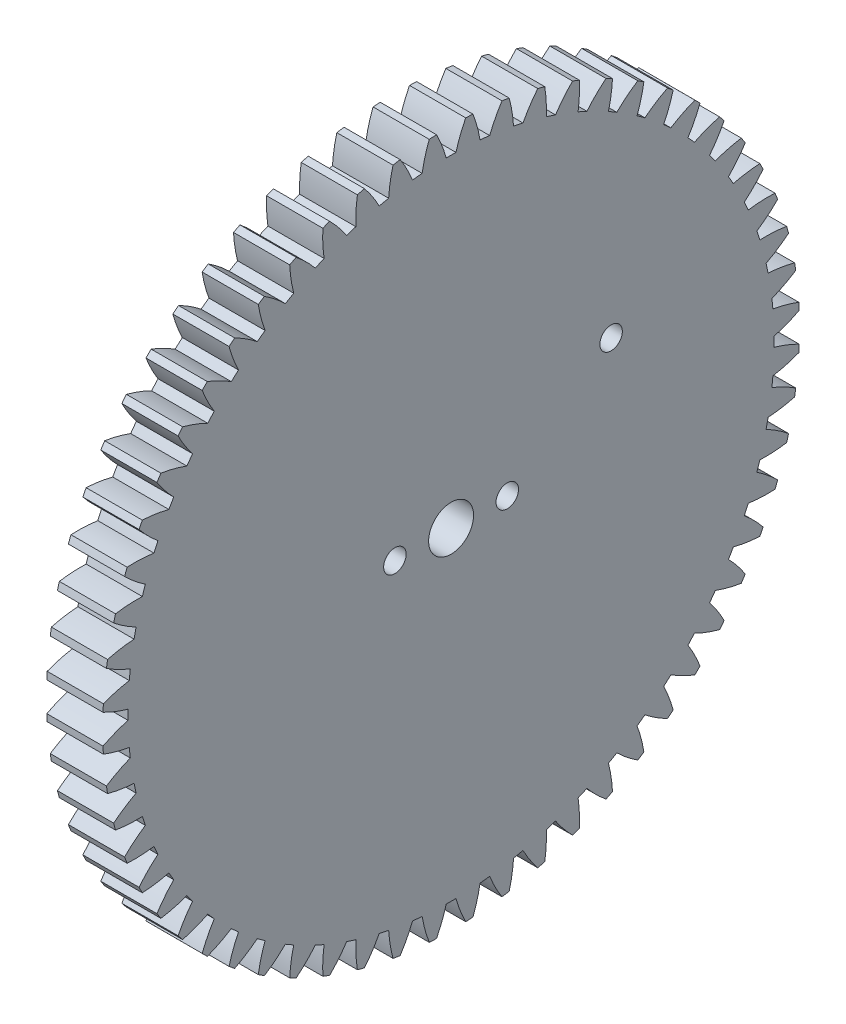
SolidWorks part; units mm, degrees
ref_plane "Front Plane" through (0, 0, 0) normal (0, 0, 1) x (1, 0, 0)
ref_plane "Top Plane" through (0, 0, 0) normal (0, 1, 0) x (1, 0, 0)
ref_plane "Right Plane" through (0, 0, 0) normal (1, 0, 0) x (0, 0, -1)
inserted part "spur gear_am<1>@tmpAssm"
sketch "Sketch1" plane through (-16.4786, 0, 0) normal (1, 0, 0) x (0, 0, -1)
  line L0 (-4.9911, 7.4255) -> (14.1403, 7.4255) construction
  line L1 (-4.9911, 7.4255) -> (-24.7748, 7.4255) construction
  line L2 (-4.9911, 7.4255) -> (20.2, 20.7839) construction
  circle A0 centre (0.0089, 7.4255) radius 1
  circle A1 centre (-9.9911, 7.4255) radius 1
  circle A2 centre (-4.9911, 7.4255) radius 2 construction
  circle A3 centre (9.2466, 14.9756) radius 1
  dimension "D1" = 5
  dimension "D2" = 5
  dimension "D4" = 16.1157
  dimension "D3" = 27.936
extrude "Cut-Extrude1" cut sketch "Sketch1" against normal blind 5
sketch "Sketch2" plane through (-16.4786, 0, 0) normal (1, 0, 0) x (0, 0, -1)
  line L0 (-8.9911, 7.4255) -> (-0.9911, 7.4255)
  circle A0 centre (-9.9911, 7.4255) radius 1 construction
  circle A1 centre (0.0089, 7.4255) radius 1 construction
